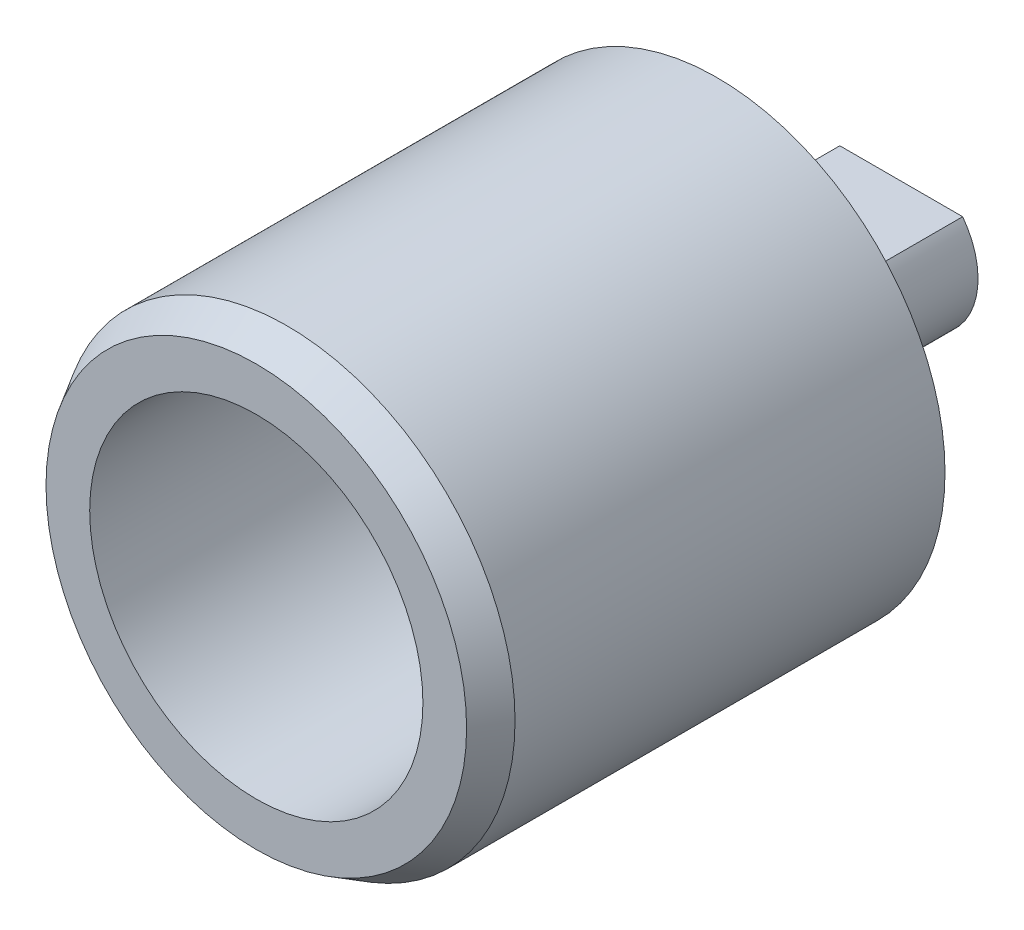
SolidWorks part; units mm, degrees
ref_plane "Front Plane" through (0, 0, 0) normal (0, 0, 1) x (1, 0, 0)
ref_plane "Top Plane" through (0, 0, 0) normal (0, 1, 0) x (1, 0, 0)
ref_plane "Right Plane" through (0, 0, 0) normal (1, 0, 0) x (0, 0, -1)
sketch "Sketch1" plane through (0, 0, 0) normal (0, 0, 1) x (1, 0, 0)
  line L0 (-2, 1.5) -> (2, 1.5)
  arc A0 (-2, 1.5) -> (2, 1.5) centre (0, 0) ccw
  dimension "D1" = 5
  dimension "D2" = 4
extrude "Boss-Extrude1" add sketch "Sketch1" against normal blind 6
sketch "Sketch4" plane through (0, 0, 0) normal (0, 0, 1) x (1, 0, 0)
  circle A0 centre (0, 0) radius 7.425
  dimension "D1" = 14.85
extrude "Boss-Extrude2" add sketch "Sketch4" along normal blind 15
sketch "Sketch7" plane through (0, 0, 15) normal (0, 0, 1) x (1, 0, 0)
  circle A2 centre (0, 0) radius 5.425
  circle A3 centre (0, 0) radius 5.425
  dimension "D1" = 2
extrude "Cut-Extrude2" cut sketch "Sketch7" against normal blind 14.5
chamfer "Chamfer3" distance 1 angle 30 1 edges at (7.425, 0, 15)
